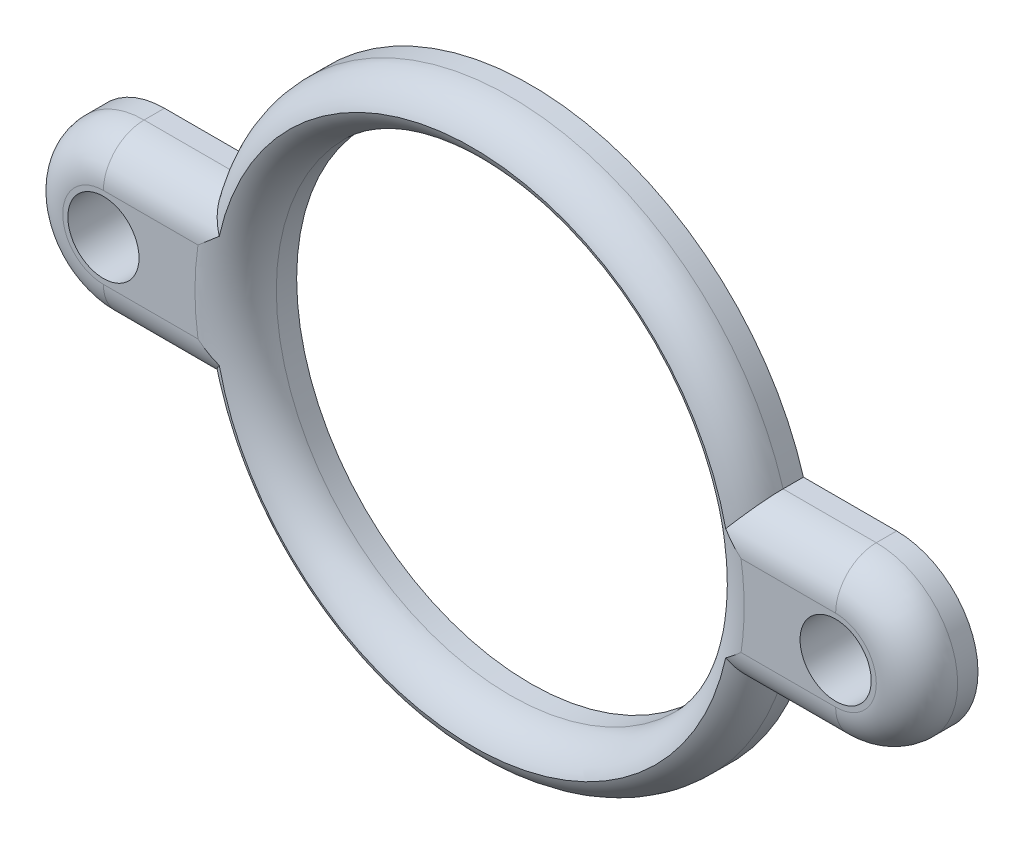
SolidWorks part; units mm, degrees
ref_plane "Front Plane" through (0, 0, 0) normal (0, 0, 1) x (1, 0, 0)
ref_plane "Top Plane" through (0, 0, 0) normal (0, 1, 0) x (1, 0, 0)
ref_plane "Right Plane" through (0, 0, 0) normal (1, 0, 0) x (0, 0, -1)
sketch "Sketch1" plane through (0, 0, 0) normal (0, 0, 1) x (1, 0, 0)
  line L0 (-18, 0) -> (18, 0) construction
  line L1 (-18, 4) -> (18, 4)
  line L2 (-18, -4) -> (18, -4)
  circle A0 centre (0, 0) radius 11.5
  circle A1 centre (0, 0) radius 14
  circle A2 centre (-18, 0) radius 1.75
  circle A3 centre (18, 0) radius 1.75
  circle A4 centre (-18, 0) radius 4
  circle A5 centre (18, 0) radius 4
  point P7 (0, 0)
  dimension "D1" = 23
  dimension "D2" = 28
  dimension "D4" = 3.5
  dimension "D3" = 36
extrude "Boss-Extrude1" add sketch "Sketch1" along normal blind 3
fillet "Fillet1" radius 2 9 edges at (15.7082, -4, 3) (22, 0, 3) (-15.7082, -4, 3) (-22, 0, 3) (0, -14, 3) (15.7082, 4, 3) (0, 14, 3) (-15.7082, 4, 3) (11.5, 0, 3)
